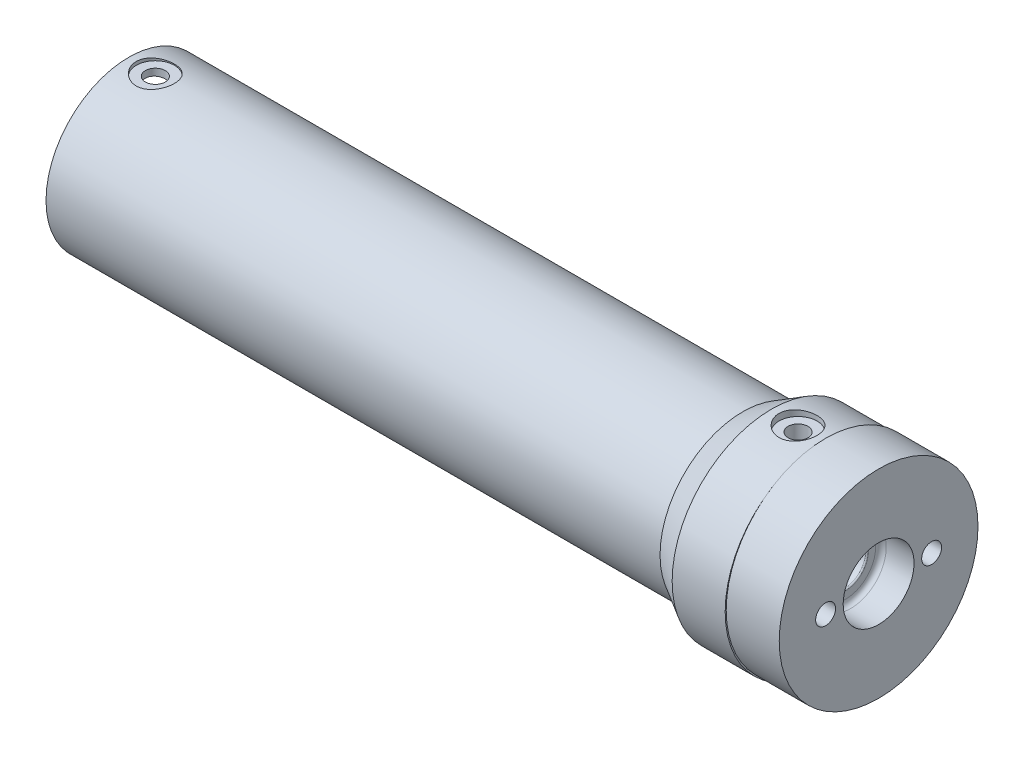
SolidWorks part; units mm, degrees
ref_plane "Plane1" through (0, 0, 0) normal (0, 0, 1) x (1, 0, 0)
ref_plane "Plane2" through (0, 0, 0) normal (0, 1, 0) x (1, 0, 0)
ref_plane "Plane3" through (0, 0, 0) normal (1, 0, 0) x (0, 0, -1)
sketch "Sketch1"
  dimension "D1" = 11
  dimension "D2" = 30
  dimension "D3" = 55
  dimension "D4" = 2
  dimension "D5" = 105
  dimension "D6" = 4.5
  dimension "D7" = 12.5
  dimension "D8" = 30
  dimension "D9" = 8
  dimension "D10" = 22
revolve "Base-Revolve" add sketch "Sketch1" angle 360 about L0
ref_plane "Plane4" through (0, 15, 0) normal (0, 1, 0) x (-1, 0, 0)
sketch "Sketch2"
  dimension "D2" = 3
  dimension "D1" = 4
extrude "Cut-Extrude1" cut sketch "Sketch2" against normal blind 12
sketch "Sketch4"
  dimension "D1" = 5.75
extrude "Cut-Extrude3" cut sketch "Sketch4" against normal blind 1
pattern_circular "CirPattern1" count 2 over 360 of "Cut-Extrude3", "Cut-Extrude1"
sketch "Sketch7"
  dimension "D2" = 3
  dimension "D1" = 4
extrude "Cut-Extrude6" cut sketch "Sketch7" against normal blind 10
pattern_circular "CirPattern3" count 2 over 360 about axis through (4, 0, 0) along (0, 1, 0) of "Cut-Extrude6"
ref_plane "Plane5" through (0, 12.5, 0) normal (0, 1, 0) x (-1, 0, 0)
sketch "Sketch8"
  dimension "D1" = 5.75
extrude "Cut-Extrude7" cut sketch "Sketch8" against normal blind 0.5
pattern_circular "CirPattern4" count 2 over 360 of "Cut-Extrude7"
sketch "Sketch9"
  dimension "D2" = 2.7
  dimension "D1" = 7
extrude "Cut-Extrude8" cut sketch "Sketch9" against normal blind 10
pattern_circular "CirPattern5" count 3 over 360 about axis through (0, 0, 0) along (1, 0, 0) of "Cut-Extrude8"
sketch "Sketch1-Gear Motor"
  dimension "D1" = 22
sketch "Sketch2-Gear Motor"
  dimension "D1" = 4
  dimension "D2" = 1.5
sketch "Sketch4-Gear Motor"
  dimension "D1" = 2.5
  dimension "D2" = 7
sketch "Sketch5-Gear Motor"
  dimension "D1" = 9
sketch "Sketch6-Gear Motor"
  dimension "D1" = 1.5
  dimension "D2" = 2
sketch "Sketch7-Gear Motor"
sketch "Sketch8-Gear Motor"
  dimension "D1" = 0.8
  dimension "D2" = 1
inserted part "Gear Motor"
move or copy body "Body-Move/Copy2"
other "<Gear Motor>-<Chamfer1>"
move or copy body "Body-Move/Copy3" bodies to move or copy 107
sketch "Sketch1-End Cap2"
  dimension "D1" = 21.75
  dimension "D2" = 10.7
  dimension "D3" = 6.5
  dimension "D4" = 5
  dimension "D5" = 8
  dimension "D6" = 17.25
  dimension "D7" = 5
  dimension "D8" = 25
  dimension "D9" = 1.655
  dimension "D10" = 3
  dimension "D11" = 21.75
  dimension "D12" = 8
  dimension "D13" = 30
  dimension "D14" = 12
  dimension "D15" = 31.5
  dimension "D16" = 8.9
sketch "Sketch9-End Cap2"
  dimension "D1" = 7.55
  dimension "D2" = 3.05
  dimension "D3" = 3.5
sketch "Sketch14-End Cap2"
inserted part "End Cap2"
move or copy body "Body-Move/Copy5"
other "<End Cap2>-<Fillet2>"
move or copy body "Body-Move/Copy6" bodies to move or copy 110
